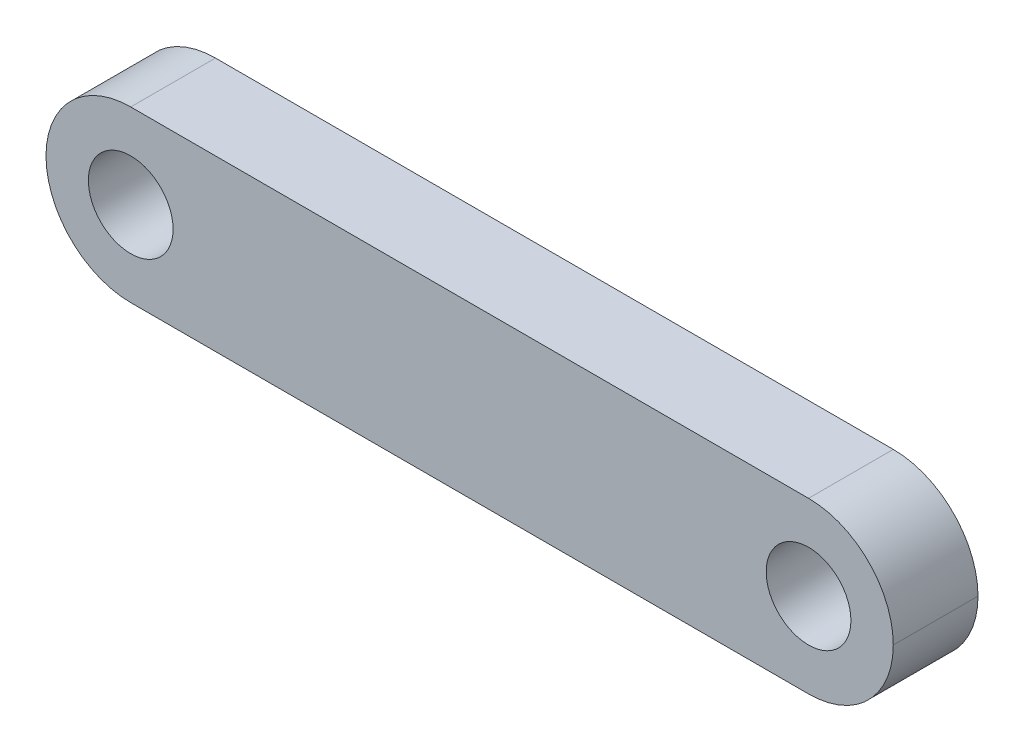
SolidWorks part; units mm, degrees
ref_plane "Front Plane" through (0, 0, 0) normal (0, 0, 1) x (1, 0, 0)
ref_plane "Top Plane" through (0, 0, 0) normal (0, 1, 0) x (1, 0, 0)
ref_plane "Right Plane" through (0, 0, 0) normal (1, 0, 0) x (0, 0, -1)
sketch "Sketch1" plane through (0, 0, 0) normal (0, 0, 1) x (1, 0, 0)
  line L1 (0, 0) -> (100, 0)
  line L2 (0, 0) -> (0, 20)
  line L3 (0, 20) -> (100, 20)
  line L4 (100, 0) -> (100, 20)
  dimension "D1" = 100
  dimension "D2" = 20
extrude "Boss-Extrude1" add sketch "Sketch1" along normal blind 10
fillet "Fillet1" radius 10 4 edges at (100, 0, 5) (100, 20, 5) (0, 0, 5) (0, 20, 5)
sketch "Sketch2" plane through (0, 0, 10) normal (0, 0, 1) x (1, 0, 0)
  line L0 (10, 0) -> (90, 0) construction
  circle A0 centre (10, 10) radius 5
  dimension "D1" = 10
  dimension "D2" = 10
  dimension "D3" = 10
extrude "Cut-Extrude1" cut sketch "Sketch2" against normal through all
sketch "Sketch3" plane through (0, 0, 10) normal (0, 0, 1) x (1, 0, 0)
  line L0 (10, 0) -> (90, 0) construction
  circle A0 centre (90, 10) radius 5
  dimension "D1" = 10
  dimension "D2" = 10
  dimension "D3" = 10
extrude "Cut-Extrude2" cut sketch "Sketch3" against normal through all
